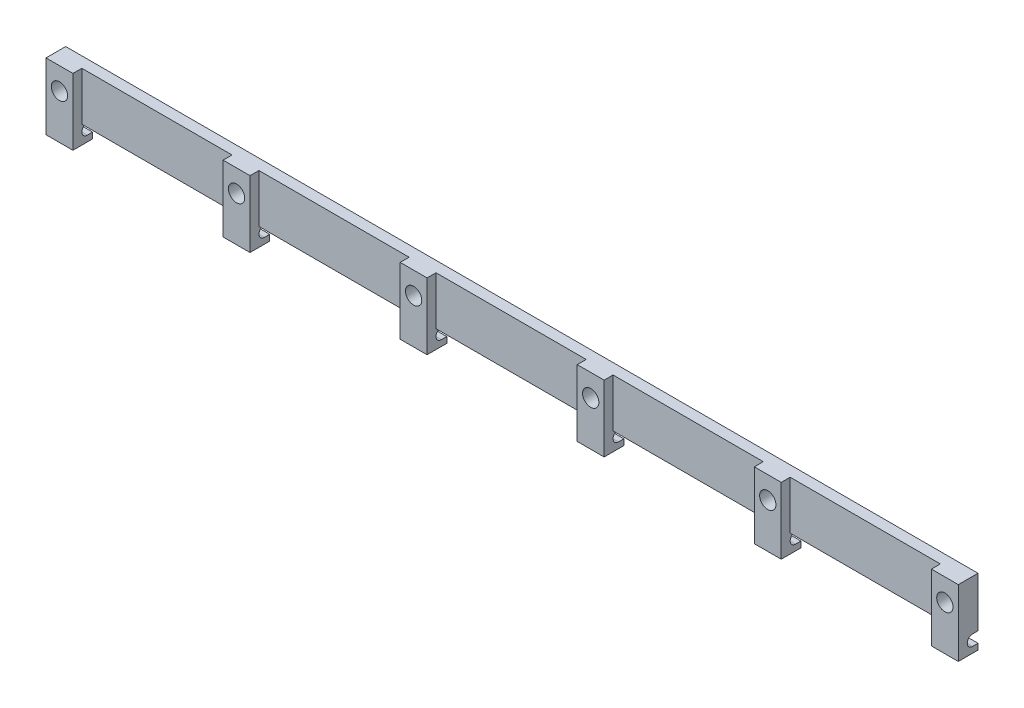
SolidWorks part; units mm, degrees
ref_plane "Front Plane" through (0, 0, 0) normal (0, 0, 1) x (1, 0, 0)
ref_plane "Top Plane" through (0, 0, 0) normal (0, 1, 0) x (1, 0, 0)
ref_plane "Right Plane" through (0, 0, 0) normal (1, 0, 0) x (0, 0, -1)
sketch "Sketch1" plane through (0, 0, 0) normal (0, 0, 1) x (1, 0, 0)
  line L0 (0, 0) -> (0, 49.3458) construction
  line L1 (-121.1326, 0) -> (121.1326, 0) construction
  line L2 (-81.788, 0) -> (-81.788, -11.938)
  line L3 (13.462, 0) -> (18.288, 0)
  line L4 (13.462, 0) -> (13.462, -11.938)
  line L5 (13.462, -11.938) -> (18.288, -11.938)
  line L6 (18.288, 0) -> (18.288, -11.938)
  line L7 (45.212, 0) -> (50.038, 0)
  line L8 (45.212, 0) -> (45.212, -11.938)
  line L9 (45.212, -11.938) -> (50.038, -11.938)
  line L10 (50.038, 0) -> (50.038, -11.938)
  line L11 (76.962, 0) -> (81.788, 0)
  line L12 (76.962, 0) -> (76.962, -11.938)
  line L13 (76.962, -11.938) -> (81.788, -11.938)
  line L14 (81.788, 0) -> (81.788, -11.938)
  line L15 (-76.962, -11.938) -> (-81.788, -11.938)
  line L16 (-76.962, 0) -> (-76.962, -11.938)
  line L17 (-76.962, 0) -> (-81.788, 0)
  line L18 (-50.038, 0) -> (-50.038, -11.938)
  line L19 (-45.212, -11.938) -> (-50.038, -11.938)
  line L20 (-45.212, 0) -> (-45.212, -11.938)
  line L21 (-45.212, 0) -> (-50.038, 0)
  line L22 (-18.288, 0) -> (-18.288, -11.938)
  line L23 (-13.462, -11.938) -> (-18.288, -11.938)
  line L24 (-13.462, 0) -> (-13.462, -11.938)
  line L25 (-13.462, 0) -> (-18.288, 0)
  point P5 (0, 0)
  point P10 (15.875, 0)
  point P15 (47.625, 0)
  point P20 (79.375, 0)
  dimension "D1" = 4.826
  dimension "D2" = 11.938
  dimension "D3" = 31.75
  dimension "D4" = 4.826
  dimension "D5" = 11.938
  dimension "D6" = 31.75
  dimension "D7" = 4.826
  dimension "D8" = 11.938
  dimension "D9" = 31.75
sketch "Sketch2" plane through (0, 0, 0) normal (0, 0, 1) x (1, 0, 0)
  line L0 (81.788, 0) -> (81.788, -11.938) construction
  line L1 (-81.788, 0) -> (81.788, 0)
  line L2 (-81.788, 0) -> (-81.788, -8.6868)
  line L3 (-81.788, -8.6868) -> (81.788, -8.6868)
  line L4 (81.788, 0) -> (81.788, -8.6868)
  dimension "D1" = 8.6868
extrude "Boss-Extrude1" add sketch "Sketch2" along normal blind 1.9304
sketch "Sketch3" plane through (0, 0, 0) normal (0, 0, -1) x (-1, 0, 0)
  line L0 (81.788, 0) -> (81.788, -11.938) construction
  line L1 (76.962, 0) -> (81.788, 0) construction
  line L2 (76.962, 0) -> (76.962, -11.938) construction
  line L3 (76.962, -11.938) -> (81.788, -11.938) construction
  line L4 (45.212, -11.938) -> (50.038, -11.938) construction
  line L5 (50.038, 0) -> (50.038, -11.938) construction
  line L6 (45.212, 0) -> (45.212, -11.938) construction
  line L7 (45.212, 0) -> (50.038, 0) construction
  line L8 (13.462, 0) -> (18.288, 0) construction
  line L9 (18.288, 0) -> (18.288, -11.938) construction
  line L10 (13.462, 0) -> (13.462, -11.938) construction
  line L11 (13.462, -11.938) -> (18.288, -11.938) construction
  line L12 (-18.288, 0) -> (-18.288, -11.938) construction
  line L13 (-13.462, 0) -> (-13.462, -11.938) construction
  line L14 (-13.462, -11.938) -> (-18.288, -11.938) construction
  line L15 (-13.462, 0) -> (-18.288, 0) construction
  line L16 (-45.212, 0) -> (-50.038, 0) construction
  line L17 (-45.212, 0) -> (-45.212, -11.938) construction
  line L18 (-50.038, 0) -> (-50.038, -11.938) construction
  line L19 (-45.212, -11.938) -> (-50.038, -11.938) construction
  line L20 (-76.962, 0) -> (-81.788, 0) construction
  line L21 (-76.962, 0) -> (-76.962, -11.938) construction
  line L22 (-81.788, 0) -> (-81.788, -11.938) construction
  line L23 (-76.962, -11.938) -> (-81.788, -11.938) construction
  line L24 (81.788, 0) -> (81.788, -11.938)
  line L25 (76.962, 0) -> (81.788, 0)
  line L26 (76.962, 0) -> (76.962, -11.938)
  line L27 (76.962, -11.938) -> (81.788, -11.938)
  line L28 (45.212, -11.938) -> (50.038, -11.938)
  line L29 (50.038, 0) -> (50.038, -11.938)
  line L30 (45.212, 0) -> (45.212, -11.938)
  line L31 (45.212, 0) -> (50.038, 0)
  line L32 (13.462, 0) -> (18.288, 0)
  line L33 (18.288, 0) -> (18.288, -11.938)
  line L34 (13.462, 0) -> (13.462, -11.938)
  line L35 (13.462, -11.938) -> (18.288, -11.938)
  line L36 (-18.288, 0) -> (-18.288, -11.938)
  line L37 (-13.462, 0) -> (-13.462, -11.938)
  line L38 (-13.462, -11.938) -> (-18.288, -11.938)
  line L39 (-13.462, 0) -> (-18.288, 0)
  line L40 (-45.212, 0) -> (-50.038, 0)
  line L41 (-45.212, 0) -> (-45.212, -11.938)
  line L42 (-50.038, 0) -> (-50.038, -11.938)
  line L43 (-45.212, -11.938) -> (-50.038, -11.938)
  line L44 (-76.962, 0) -> (-81.788, 0)
  line L45 (-76.962, 0) -> (-76.962, -11.938)
  line L46 (-81.788, 0) -> (-81.788, -11.938)
  line L47 (-76.962, -11.938) -> (-81.788, -11.938)
extrude "Boss-Extrude2" add sketch "Sketch3" against normal blind 3.5306
sketch "Sketch4" plane through (0, 0, 3.5306) normal (0, 0, 1) x (1, 0, 0)
  line L0 (-79.375, 0) -> (-79.375, -9.1619) construction
  line L1 (-81.788, 0) -> (-76.962, 0) construction
  circle A0 centre (-79.375, -3.9624) radius 1.4605
  dimension "D1" = 2.921
  dimension "D2" = 3.9624
extrude "Cut-Extrude1" cut sketch "Sketch4" against normal through all
pattern_linear "LPattern1" count 6 spacing 31.75 along (1, 0, 0) of "Cut-Extrude1"
sketch "Sketch5" plane through (0, 0, 0) normal (0, 0, -1) x (-1, 0, 0)
  line L0 (79.375, -3.9624) -> (47.625, -3.9624) construction
  line L1 (81.788, 0) -> (81.788, -11.938) construction
  circle A0 centre (63.5635, -3.9624) radius 2.1209
  dimension "D1" = 16.1036
  dimension "D2" = 4.2418
extrude "Boss-Extrude3" add sketch "Sketch5" along normal blind 1.27
sketch "Sketch6" plane through (-81.788, 0, 0) normal (-1, 0, 0) x (0, 0, 1)
  line L0 (0.9652, -10.8712) -> (0, -10.8712)
  line L1 (0.9652, -8.9408) -> (0, -8.9408)
  line L2 (0, 0) -> (0, -11.938) construction
  line L3 (0, -8.9408) -> (0, -10.8712)
  line L4 (3.5306, -11.938) -> (0, -11.938) construction
  arc A0 (0.9652, -10.8712) -> (0.9652, -8.9408) centre (0.9652, -9.906) ccw
  dimension "D1" = 0.9652
  dimension "D3" = 2.032
  dimension "D2" = 0.9652
extrude "Cut-Extrude2" cut sketch "Sketch6" against normal through all
